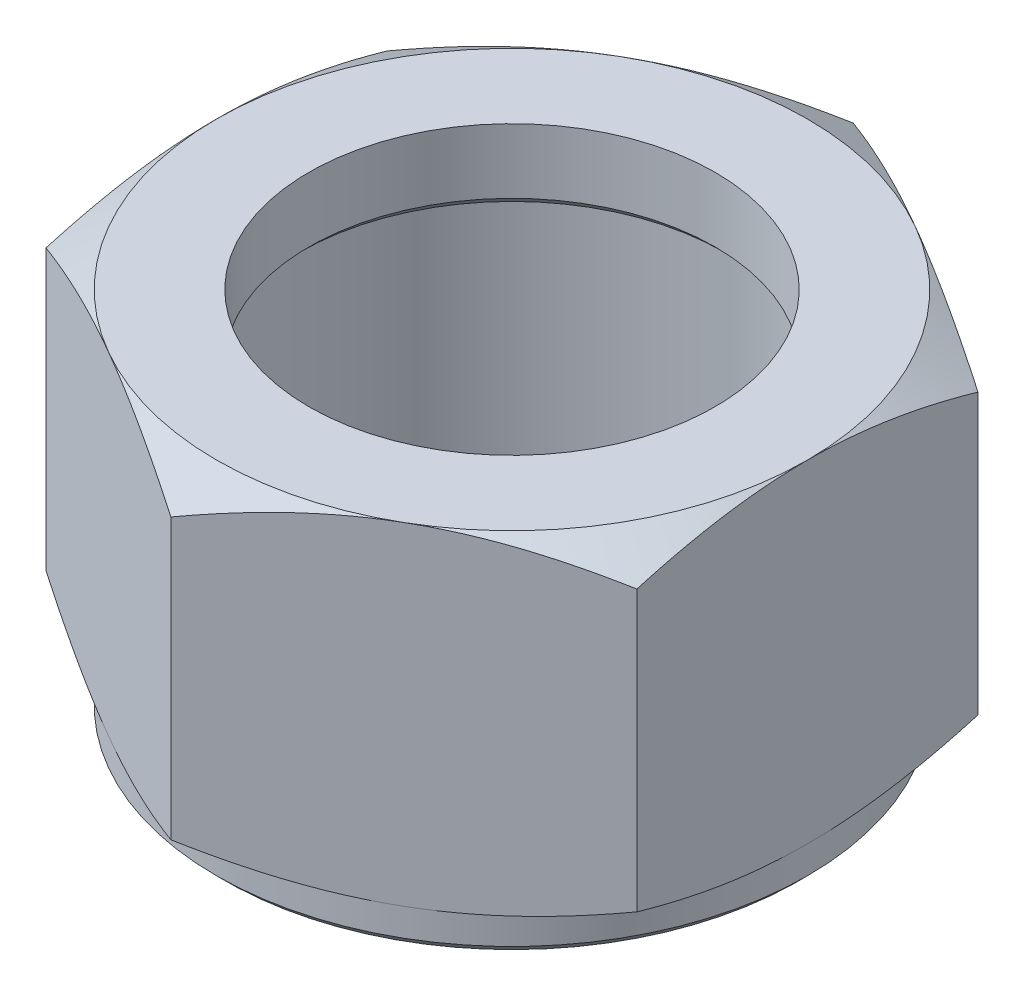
SolidWorks part; units mm, degrees
ref_plane "Přední rovina" through (0, 0, 0) normal (0, 0, 1) x (1, 0, 0)
ref_plane "Horní rovina" through (0, 0, 0) normal (0, 1, 0) x (1, 0, 0)
ref_plane "Pravá rovina" through (0, 0, 0) normal (1, 0, 0) x (0, 0, -1)
sketch "Skica1" plane through (0, 0, 0) normal (0, 1, 0) x (1, 0, 0)
  line L1 (0, 18.4752) -> (-16, 9.2376)
  line L2 (-16, 9.2376) -> (-16, -9.2376)
  line L3 (-16, -9.2376) -> (0, -18.4752)
  line L4 (0, -18.4752) -> (16, -9.2376)
  line L5 (16, -9.2376) -> (16, 9.2376)
  line L6 (16, 9.2376) -> (0, 18.4752)
  circle A0 centre (0, 0) radius 16 construction
extrude "Přidat vysunutím1" add sketch "Skica1" along normal blind 18
sketch "Skica2" plane through (0, 18, 0) normal (0, 1, 0) x (1, 0, 0)
  circle A0 centre (0, 0) radius 16
extrude "Odebrat vysunutím1" cut sketch "Skica2" against normal blind 18 draft 60 flip side to cut
sketch "Skica3" plane through (0, 0, 0) normal (0, -1, 0) x (1, 0, 0)
  circle A0 centre (0, 0) radius 16
extrude "Odebrat vysunutím2" cut sketch "Skica3" against normal blind 18 draft 60 flip side to cut
sketch "Skica4" plane through (0, 0, 0) normal (0, -1, 0) x (1, 0, 0)
  circle A0 centre (0, 0) radius 16
extrude "Přidat vysunutím2" add sketch "Skica4" along normal blind 2
chamfer "Zkosení1" distance 0.5 angle 45 1 edges at (0, -2, -16)
sketch "Skica5" plane through (0, -2, 0) normal (0, -1, 0) x (1, 0, 0)
  circle A0 centre (0, 0) radius 13
extrude "Odebrat vysunutím3" cut sketch "Skica5" against normal blind 16
sketch "Skica6" plane through (0, 18, 0) normal (0, 1, 0) x (1, 0, 0)
  circle A0 centre (0, 0) radius 11
extrude "Odebrat vysunutím4" cut sketch "Skica6" against normal up to next
chamfer "Zkosení2" distance 0.5 angle 45 1 edges at (0, 14, -11)
